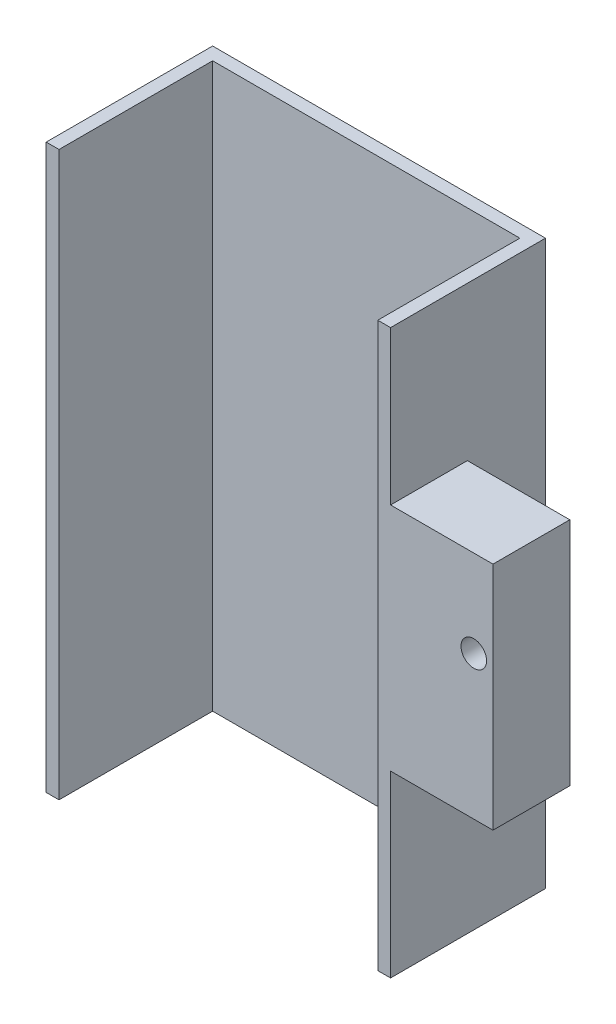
SolidWorks part; units mm, degrees
ref_plane "Face" through (0, 0, 0) normal (0, 0, 1) x (1, 0, 0)
ref_plane "Dessus" through (0, 0, 0) normal (0, 1, 0) x (1, 0, 0)
ref_plane "Droite" through (0, 0, 0) normal (1, 0, 0) x (0, 0, -1)
sketch "Esquisse1" plane through (0, 0, 0) normal (0, 1, 0) x (1, 0, 0)
  line L0 (0, 137.2339) -> (0, -145.0386) construction
  line L1 (-189, 120) -> (51, 120)
  line L2 (-189, 120) -> (-189, 0)
  line L3 (61, 130) -> (61, -130) construction
  line L4 (51, 120) -> (51, 0)
  line L5 (-199, 130) -> (61, 130)
  line L6 (61, 130) -> (61, 0)
  line L7 (51, 120) -> (51, -120) construction
  line L8 (-199, 130) -> (-199, 0)
  line L9 (-199, 0) -> (-189, 0)
  line L10 (-199, -130) -> (61, -130) construction
  line L11 (-189, -120) -> (51, -120) construction
  line L12 (-199, 130) -> (-199, -130) construction
  line L13 (-189, 120) -> (-189, -120) construction
  line L14 (51, 0) -> (61, 0)
  dimension "D1" = 120
  dimension "D3" = 240
  dimension "D4" = 189
  dimension "D5" = 10
extrude "Extrusion1" add sketch "Esquisse1" along normal blind 440
sketch "Esquisse2" plane through (61, 0, 0) normal (1, 0, 0) x (0, 0, -1)
  line L0 (0, 440) -> (130, 440) construction
  line L1 (9, 320) -> (69, 320)
  line L2 (9, 320) -> (9, 140)
  line L3 (9, 140) -> (69, 140)
  line L4 (69, 320) -> (69, 140)
  line L5 (130, 440) -> (130, 0) construction
  dimension "D1" = 60
  dimension "D2" = 180
  dimension "D3" = 120
  dimension "D5" = 121
extrude "Extrusion2" add sketch "Esquisse2" along normal blind 80
sketch "Esquisse3" plane through (61, 0, 0) normal (1, 0, 0) x (0, 0, -1)
  line L0 (9, 320) -> (9, 140) construction
  line L1 (9, 453.7907) -> (-54.1275, 453.7907)
  line L2 (9, 453.7907) -> (9, -7.8719)
  line L3 (9, -7.8719) -> (-54.1275, -7.8719)
  line L4 (-54.1275, 453.7907) -> (-54.1275, -7.8719)
extrude "Enlèv. mat.-Extru.1" cut sketch "Esquisse3" against normal blind 80
sketch "Esquisse4" plane through (0, 0, -9) normal (0, 0, 1) x (1, 0, 0)
  line L0 (141, 320) -> (61, 320) construction
  line L1 (51, 0) -> (51, 440) construction
  circle A0 centre (126, 252.03) radius 10
  dimension "D1" = 20
  dimension "D2" = 75
  dimension "D3" = 67.97
extrude "Enlèv. mat.-Extru.2" cut sketch "Esquisse4" against normal through all
